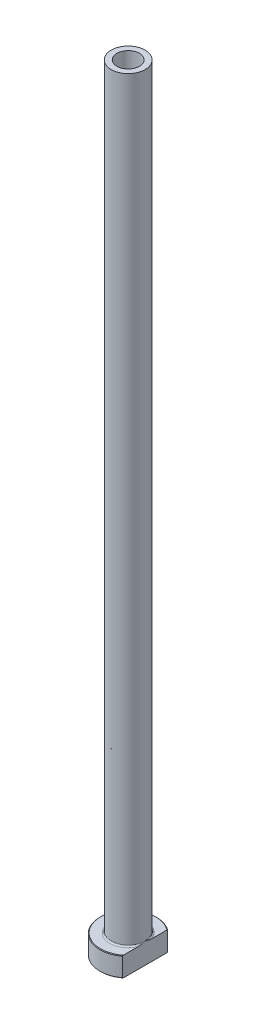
SolidWorks part; units mm, degrees
ref_plane "Front Plane" through (0, 0, 0) normal (0, 0, 1) x (1, 0, 0)
ref_plane "Top Plane" through (0, 0, 0) normal (0, 1, 0) x (1, 0, 0)
ref_plane "Right Plane" through (0, 0, 0) normal (1, 0, 0) x (0, 0, -1)
sketch "Sketch1" plane through (0, 0, 0) normal (0, 0, 1) x (1, 0, 0)
  line L0 (-4, 275) -> (-6, 275)
  line L1 (-6, 275) -> (-6, 7)
  line L2 (-6, 7) -> (-10, 7)
  line L3 (-10, 7) -> (-10, 0)
  line L4 (8.8, 0) -> (-8.8, 0) construction
  line L5 (-10, 0) -> (-4.25, 0)
  line L6 (-4, 230) -> (-4, 275)
  line L7 (0, 92.1877) -> (0, -15.5353) construction
  line L8 (0, -11) -> (0, 11) construction
  line L9 (-4, 230) -> (-4.25, 218)
  line L10 (-4.25, 218) -> (-4.25, 0)
  dimension "D1" = 0.25
  dimension "ID" = 8
  dimension "OD" = 12
  dimension "L" = 275
  dimension "H" = 20
  dimension "T" = 7
  dimension "N" = 45
  dimension "D2" = 12
  dimension "L-N" = 230
revolve "Revolve1" add sketch "Sketch1" angle 360 about L7
fillet "Fillet1" radius 0.5 1 edges at (0, 7, 6)
chamfer "Chamfer1" distance 0.2 angle 45 2 edges at (0, 7, 10) (0, 0, 10)
sketch "Sketch2" plane through (0, 0, 0) normal (0, -1, 0) x (1, 0, 0)
  line L0 (6, 8) -> (6, -8)
  circle A0 centre (0, 0) radius 10 construction
  arc A1 (6, 8) -> (6, -8) centre (0, 0) cw
  circle A2 centre (0, 0) radius 6 construction
extrude "Cut-Extrude1" cut sketch "Sketch2" against normal through all
chamfer "Chamfer2" distance 0.5 angle 45 1 edges at (0, 0, 4.25)
